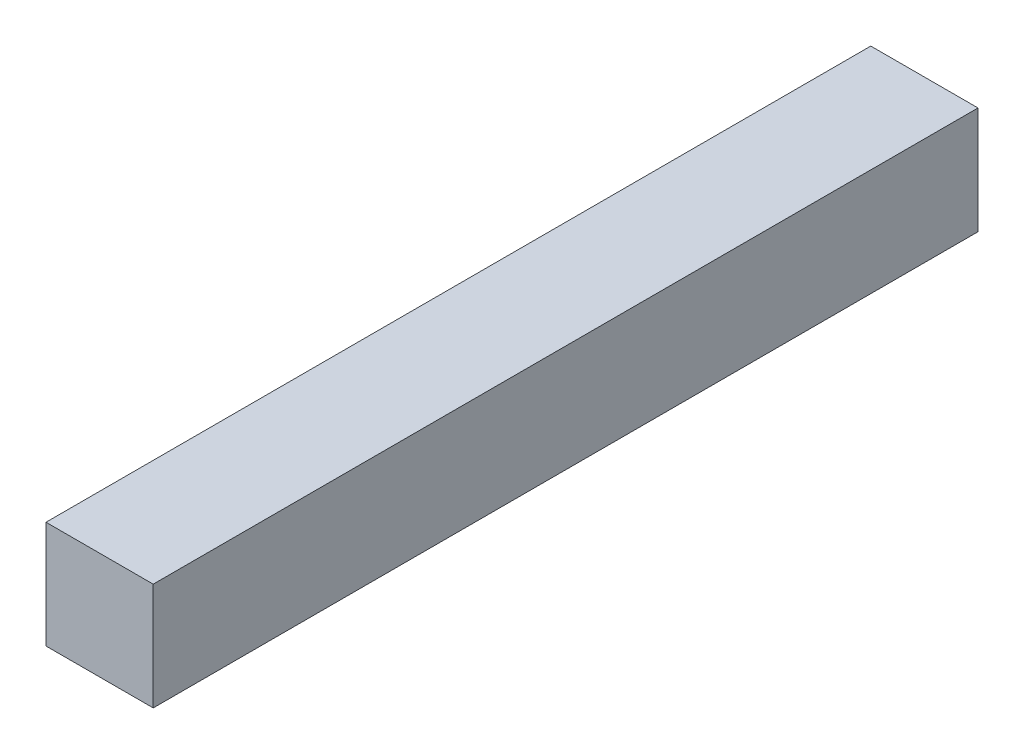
SolidWorks part; units mm, degrees
ref_plane "Plan de face" through (0, 0, 0) normal (0, 0, 1) x (1, 0, 0)
ref_plane "Plan de dessus" through (0, 0, 0) normal (0, 1, 0) x (1, 0, 0)
ref_plane "Plan de droite" through (0, 0, 0) normal (1, 0, 0) x (0, 0, -1)
sketch "Esquisse1" plane through (0, 0, 0) normal (0, 0, 1) x (1, 0, 0)
  line L1 (-6.5, 6.5) -> (6.5, 6.5)
  line L2 (-6.5, 6.5) -> (-6.5, -6.5)
  line L3 (-6.5, -6.5) -> (6.5, -6.5)
  line L4 (6.5, 6.5) -> (6.5, -6.5)
  point P4 (0, 6.5)
  point P5 (-6.5, 0)
  dimension "D1" = 13
extrude "Extrusion1" add sketch "Esquisse1" along normal mid plane 100
